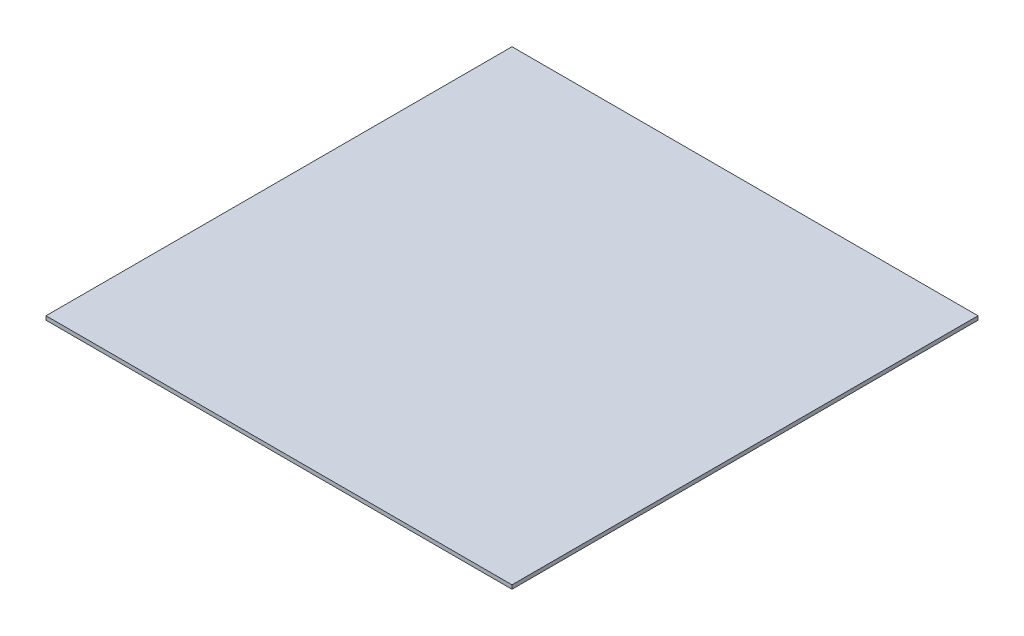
SolidWorks part; units mm, degrees
ref_plane "Front" through (0, 0, 0) normal (0, 0, 1) x (1, 0, 0)
ref_plane "Top" through (0, 0, 0) normal (0, 1, 0) x (1, 0, 0)
ref_plane "Right" through (0, 0, 0) normal (1, 0, 0) x (0, 0, -1)
sketch "Sketch1" plane through (0, 0, 0) normal (0, 1, 0) x (1, 0, 0)
  line L1 (152.4, 152.4) -> (-152.4, 152.4)
  line L2 (152.4, 152.4) -> (152.4, -152.4)
  line L3 (152.4, -152.4) -> (-152.4, -152.4)
  line L4 (-152.4, 152.4) -> (-152.4, -152.4)
  line L5 (152.4, 152.4) -> (-152.4, -152.4) construction
  line L6 (152.4, -152.4) -> (-152.4, 152.4) construction
  point P0 (0, 0)
  dimension "D1" = 304.8
  dimension "D2" = 304.8
extrude "Boss-Extrude1" add sketch "Sketch1" along normal blind 2.54
